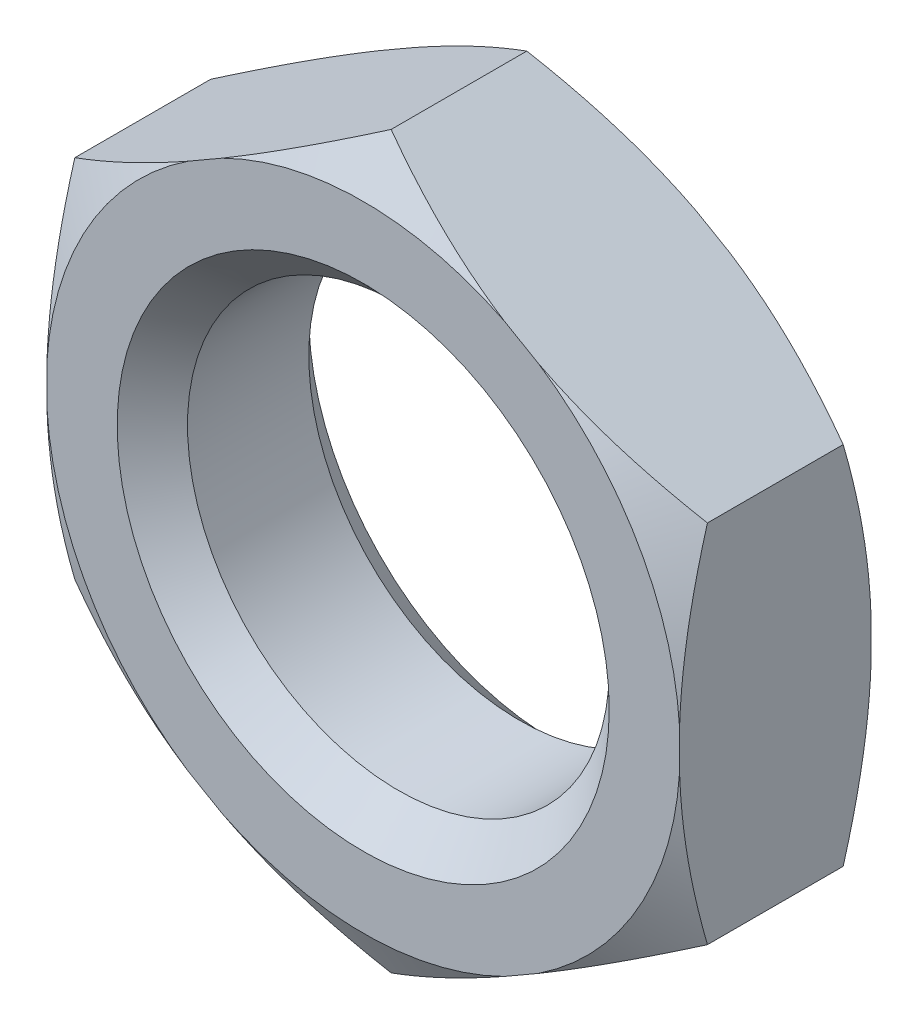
SolidWorks part; units mm, degrees
ref_plane "Front Plane" through (0, 0, 0) normal (0, 0, 1) x (1, 0, 0)
ref_plane "Top Plane" through (0, 0, 0) normal (0, 1, 0) x (1, 0, 0)
ref_plane "Right Plane" through (0, 0, 0) normal (1, 0, 0) x (0, 0, -1)
sketch "Sketch3" plane through (0, 0, 0) normal (0, 0, 1) x (1, 0, 0)
  line L1 (0, 20.7846) -> (-18, 10.3923)
  line L2 (-18, 10.3923) -> (-18, -10.3923)
  line L3 (-18, -10.3923) -> (0, -20.7846)
  line L4 (0, -20.7846) -> (18, -10.3923)
  line L5 (18, -10.3923) -> (18, 10.3923)
  line L6 (18, 10.3923) -> (0, 20.7846)
  circle A0 centre (0, 0) radius 18 construction
  dimension "D1" = 36
extrude "Boss-Extrude1" add sketch "Sketch3" along normal mid plane 10.9
sketch "Sketch4" plane through (0, 0, 0) normal (1, 0, 0) x (0, 0, -1)
  line L0 (-5.4578, 0) -> (6.1545, 0) construction
sketch "Sketch5" plane through (0, 0, 0) normal (1, 0, 0) x (0, 0, -1)
  line L0 (-5.45, 20.7846) -> (-5.45, 18.0346)
  line L1 (-5.45, 10.3923) -> (-5.45, 20.7846) construction
  line L2 (-5.45, 18.0346) -> (-3.8623, 20.7846)
  line L3 (-5.45, 20.7846) -> (5.45, 20.7846) construction
  line L4 (-3.8623, 20.7846) -> (-5.45, 20.7846)
  dimension "D1" = 2.75
  dimension "D2" = 30
revolve "Cut-Revolve1" cut sketch "Sketch5" angle 360 about L0
mirror "Mirror1" about plane through (0, 0, 0) normal (0, 0, 1) of "Cut-Revolve1"
sketch "Sketch6" plane through (0, 0, 5.45) normal (0, 0, 1) x (1, 0, 0)
  circle A0 centre (0, 0) radius 12
  dimension "D1" = 24
extrude "Cut-Extrude1" cut sketch "Sketch6" against normal blind 10.9
chamfer "Chamfer1" distance 2 angle 45 2 edges at (12, 0, -5.45) (12, 0, 5.45)
